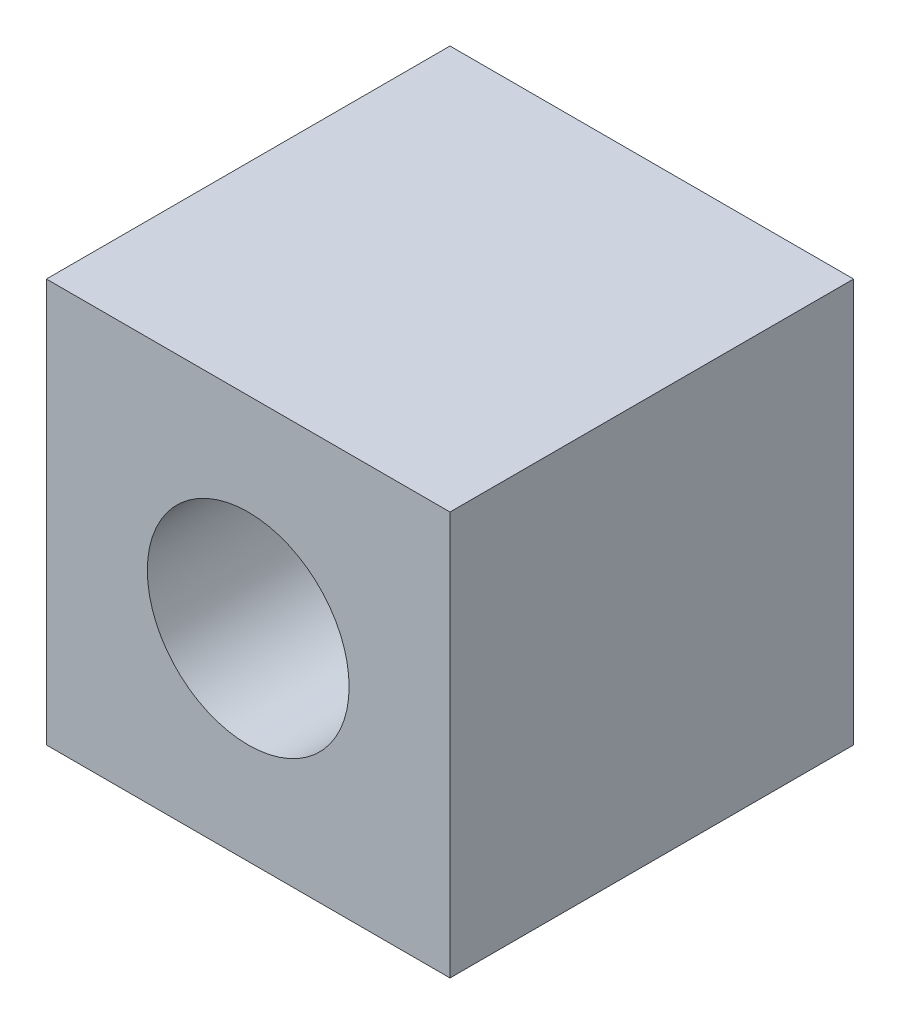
SolidWorks part; units mm, degrees
ref_plane "Front Plane" through (0, 0, 0) normal (0, 0, 1) x (1, 0, 0)
ref_plane "Top Plane" through (0, 0, 0) normal (0, 1, 0) x (1, 0, 0)
ref_plane "Right Plane" through (0, 0, 0) normal (1, 0, 0) x (0, 0, -1)
sketch "Sketch1" plane through (0, 0, 0) normal (0, 0, 1) x (1, 0, 0)
  line L1 (-5, -5) -> (5, -5)
  line L2 (-5, -5) -> (-5, 5)
  line L3 (-5, 5) -> (5, 5)
  line L4 (5, -5) -> (5, 5)
  line L5 (-5, -5) -> (5, 5) construction
  line L6 (-5, 5) -> (5, -5) construction
  point P0 (0, 0)
  dimension "D1" = 10
extrude "Boss-Extrude1" add sketch "Sketch1" along normal mid plane 10
sketch "Sketch2" plane through (0, 0, 0) normal (0, 0, 1) x (1, 0, 0)
  circle A0 centre (0, 0) radius 2.5
  dimension "D1" = 5
extrude "Cut-Extrude1" cut sketch "Sketch2" against normal through all and the other way through all
